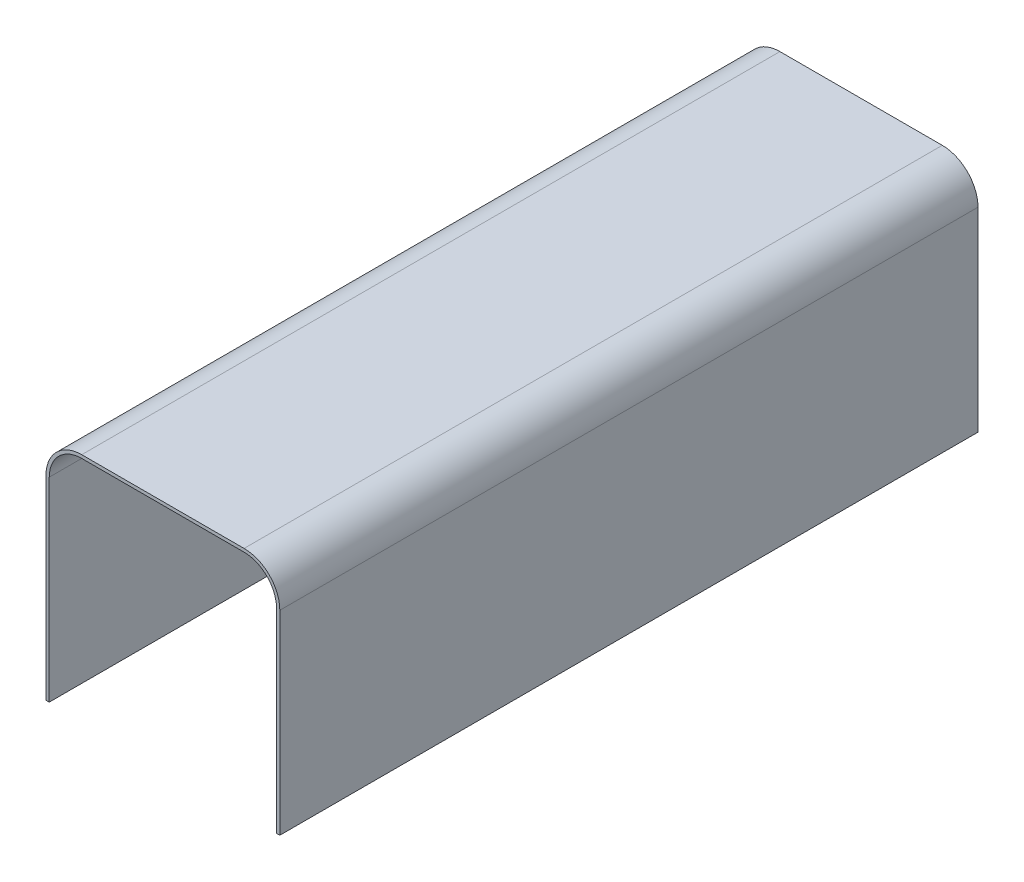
SolidWorks part; units mm, degrees
ref_plane "Front Plane" through (0, 0, 0) normal (0, 0, 1) x (1, 0, 0)
ref_plane "Top Plane" through (0, 0, 0) normal (0, 1, 0) x (1, 0, 0)
ref_plane "Right Plane" through (0, 0, 0) normal (1, 0, 0) x (0, 0, -1)
sketch "Sketch1" plane through (0, 0, 0) normal (0, 0, 1) x (1, 0, 0)
  line L0 (0, 0) -> (0, 60)
  line L1 (10, 70) -> (60, 70)
  line L2 (70, 60) -> (70, 0)
  line L3 (-1, 0) -> (-1, 60)
  line L4 (10, 71) -> (60, 71)
  line L5 (71, 60) -> (71, 0)
  line L6 (-1, 0) -> (0, 0)
  line L7 (70, 0) -> (71, 0)
  arc A0 (60, 70) -> (70, 60) centre (60, 60) cw
  arc A1 (0, 60) -> (10, 70) centre (10, 60) cw
  arc A2 (-1, 60) -> (10, 71) centre (10, 60) cw
  arc A3 (60, 71) -> (71, 60) centre (60, 60) cw
  point P7 (70, 70)
  point P10 (0, 70)
  dimension "D3" = 10
  dimension "D1" = 70
  dimension "D2" = 70
  dimension "D4" = 1
extrude "Boss-Extrude1" add sketch "Sketch1" along normal blind 215
